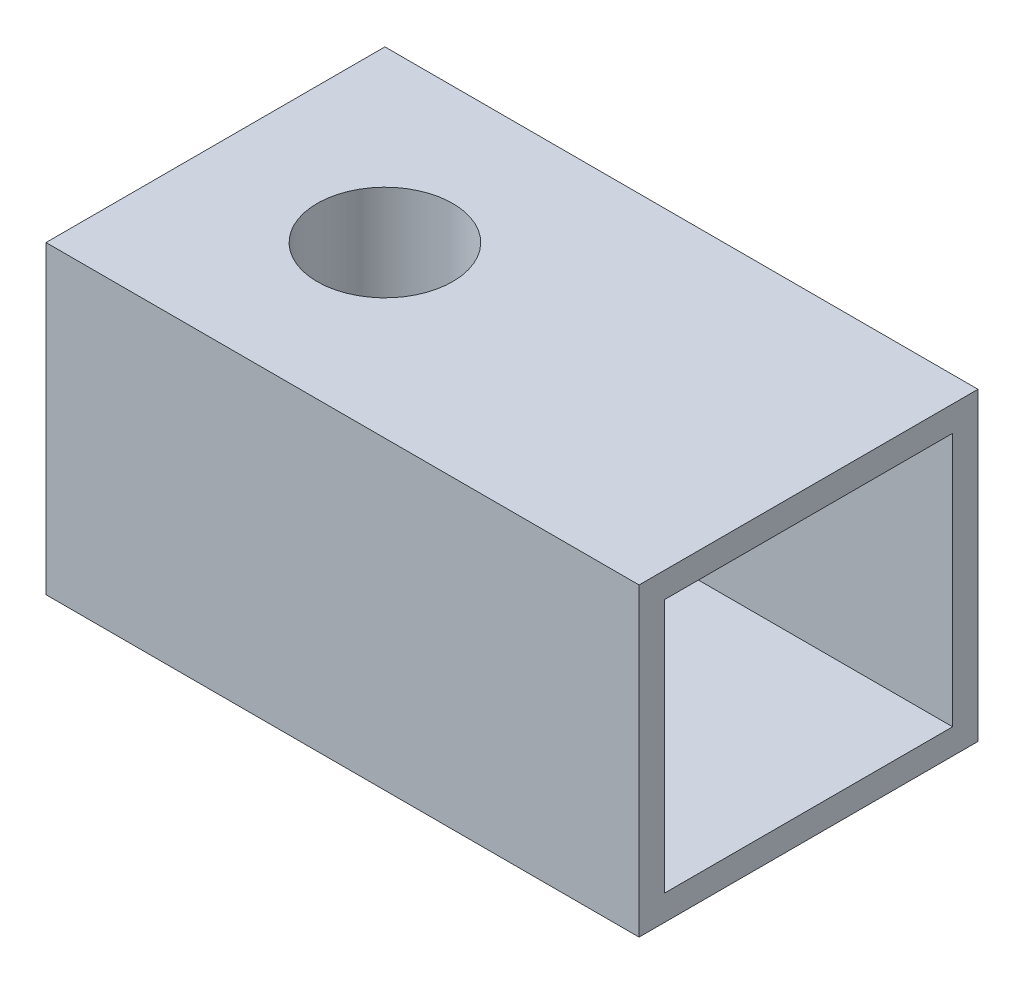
SolidWorks part; units mm, degrees
ref_plane "Front Plane" through (0, 0, 0) normal (0, 0, 1) x (1, 0, 0)
ref_plane "Top Plane" through (0, 0, 0) normal (0, 1, 0) x (1, 0, 0)
ref_plane "Right Plane" through (0, 0, 0) normal (1, 0, 0) x (0, 0, -1)
sketch "Sketch1" plane through (0, 0, 0) normal (0, 1, 0) x (1, 0, 0)
  line L1 (-17.5, 10) -> (17.5, 10)
  line L2 (-17.5, 10) -> (-17.5, -10)
  line L3 (-17.5, -10) -> (17.5, -10)
  line L4 (17.5, 10) -> (17.5, -10)
  line L5 (-17.5, 10) -> (17.5, -10) construction
  line L6 (-17.5, -10) -> (17.5, 10) construction
  circle A0 centre (-7.5, 0) radius 4
  point P0 (0, 0)
  dimension "D3" = 8
  dimension "D1" = 35
  dimension "D2" = 20
  dimension "D4" = 25
  dimension "D5" = 10
extrude "Boss-Extrude1" add sketch "Sketch1" along normal blind 18
sketch "Sketch4" plane through (17.5, 0, 0) normal (1, 0, 0) x (0, 0, -1)
  line L0 (10, 18) -> (10, 0) construction
  line L1 (-8.5, 16.5) -> (8.5, 16.5)
  line L2 (-8.5, 16.5) -> (-8.5, 1.5)
  line L3 (-8.5, 1.5) -> (8.5, 1.5)
  line L4 (8.5, 16.5) -> (8.5, 1.5)
  line L5 (-8.5, 16.5) -> (8.5, 1.5) construction
  line L6 (-8.5, 1.5) -> (8.5, 16.5) construction
  line L7 (-10, 0) -> (10, 0) construction
  line L8 (-10, 18) -> (-10, 0) construction
  line L9 (-10, 18) -> (10, 18) construction
  point P0 (0, 9)
  dimension "D1" = 1.5
  dimension "D2" = 1.5
  dimension "D3" = 1.5
  dimension "D4" = 1.5
  dimension "D5" = 17
extrude "Cut-Extrude1" cut sketch "Sketch4" against normal blind 20
sketch "Sketch5" plane through (0, 0, -8.5) normal (0, 0, 1) x (1, 0, 0)
  line L0 (-2.5, 1.5) -> (-2.5, 16.5) construction
  line L1 (2.5, 16.5) -> (-2.5, 16.5)
  line L2 (2.5, 16.5) -> (2.5, 1.5)
  line L3 (2.5, 1.5) -> (-2.5, 1.5)
  line L4 (-2.5, 16.5) -> (-2.5, 1.5)
  line L5 (2.5, 16.5) -> (-2.5, 1.5) construction
  line L6 (2.5, 1.5) -> (-2.5, 16.5) construction
  point P0 (0, 9)
  dimension "D1" = 5
extrude "Cut-Extrude2" cut sketch "Sketch5" against normal blind 3
